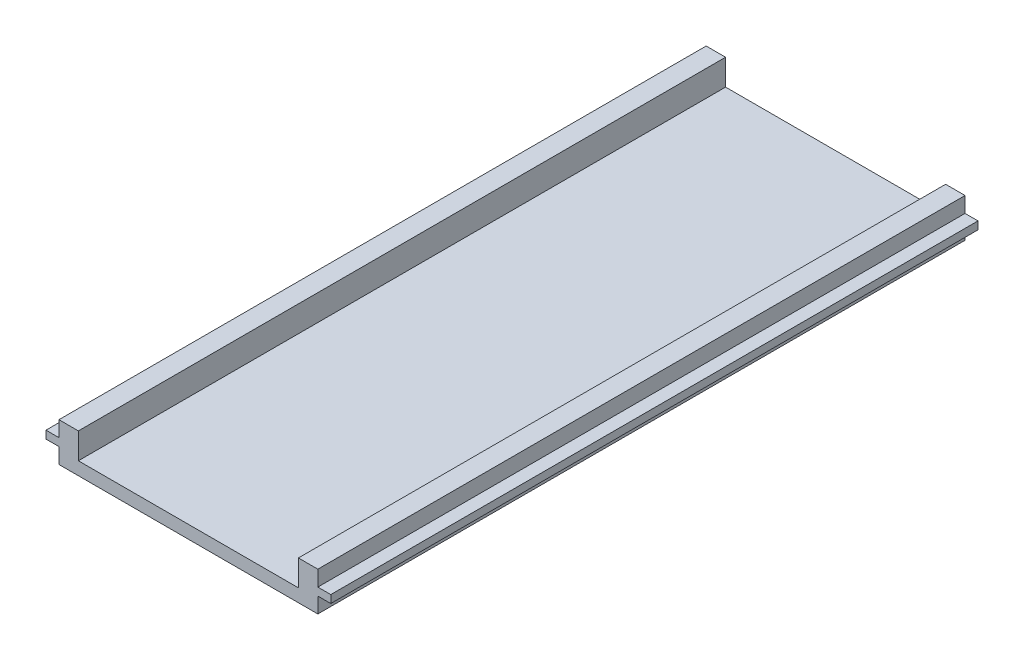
SolidWorks part; units mm, degrees
ref_plane "Plan de face" through (0, 0, 0) normal (0, 0, 1) x (1, 0, 0)
ref_plane "Plan de dessus" through (0, 0, 0) normal (0, 1, 0) x (1, 0, 0)
ref_plane "Plan de droite" through (0, 0, 0) normal (1, 0, 0) x (0, 0, -1)
sketch "Esquisse1" plane through (0, 0, 0) normal (0, 0, 1) x (1, 0, 0)
  line L0 (4.732, 0) -> (24.732, 0)
  line L1 (24.732, 0) -> (24.732, 1.2)
  line L2 (4.732, 0) -> (4.732, 1.2)
  line L3 (24.732, 1.2) -> (25.732, 1.2)
  line L4 (4.732, 1.2) -> (3.732, 1.2)
  line L5 (3.732, 1.2) -> (3.732, 1.8)
  line L6 (3.732, 1.8) -> (4.732, 1.8)
  line L7 (4.732, 1.8) -> (4.732, 3)
  line L8 (25.732, 1.2) -> (25.732, 1.8)
  line L9 (25.732, 1.8) -> (24.732, 1.8)
  line L10 (24.732, 1.8) -> (24.732, 3)
  line L11 (4.732, 3) -> (6.232, 3)
  line L12 (6.232, 3) -> (6.232, 1)
  line L13 (6.232, 1) -> (23.232, 1)
  line L14 (23.232, 1) -> (23.232, 3)
  line L15 (23.232, 3) -> (24.732, 3)
extrude "Boss.-Extru.1" add sketch "Esquisse1" along normal blind 50
